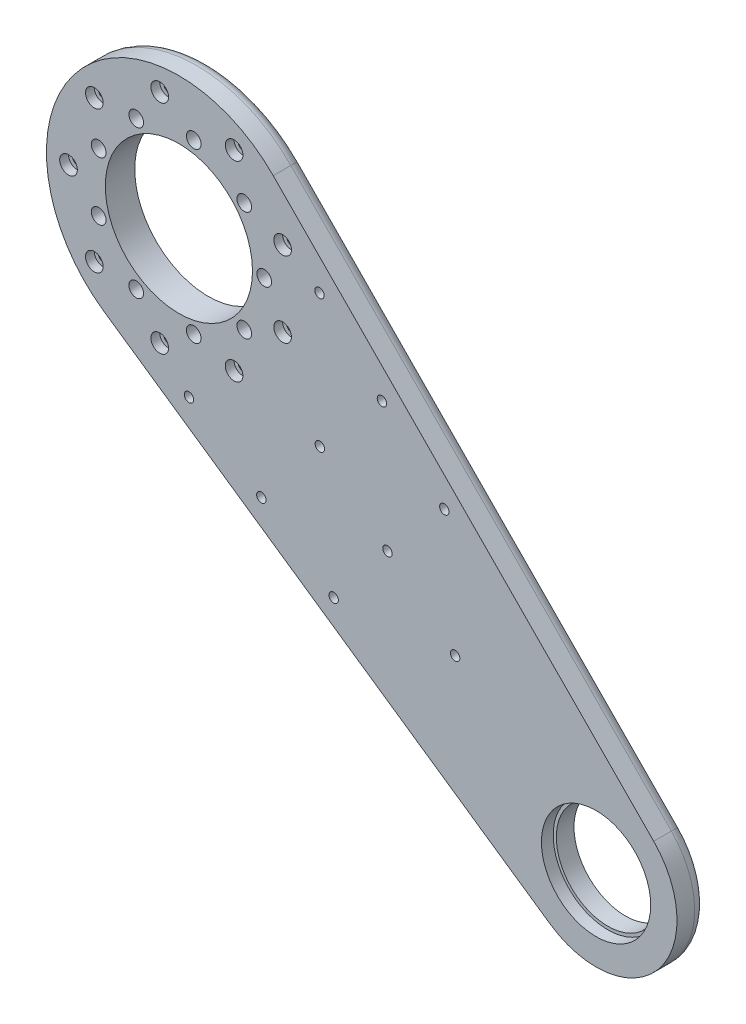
SolidWorks part; units mm, degrees
ref_plane "Front Plane" through (0, 0, 0) normal (0, 0, 1) x (1, 0, 0)
ref_plane "Top Plane" through (0, 0, 0) normal (0, 1, 0) x (1, 0, 0)
ref_plane "Right Plane" through (0, 0, 0) normal (1, 0, 0) x (0, 0, -1)
sketch "Sketch1" plane through (0, 0, 0) normal (0, 0, 1) x (1, 0, 0)
  line L0 (141.7182, -118.9157) -> (13.1607, -272.1246) construction
  line L1 (26.7138, 26.3177) -> (155.9656, -104.8796) construction
  line L2 (-25.5349, -37.0536) -> (126.1136, -141.5596)
  line L3 (32.0566, 31.5812) -> (161.3084, -99.6161)
  line L4 (-21.2791, -30.878) -> (130.3694, -135.384) construction
  line L5 (0, 0) -> (141.7182, -118.9157) construction
  arc A0 (32.0566, 31.5812) -> (-25.5349, -37.0536) centre (0, 0) ccw
  arc A1 (126.1136, -141.5596) -> (161.3084, -99.6161) centre (141.7182, -118.9157) ccw
  circle A5 centre (0, 0) radius 25 construction
  circle A6 centre (0, 0) radius 37.5 construction
  circle A7 centre (141.7182, -118.9157) radius 17.5
  circle A8 centre (70.8591, -59.4579) radius 1.6
  circle A9 centre (93.8404, -78.7415) radius 1.6
  circle A10 centre (47.8778, -40.1742) radius 1.6
  circle A11 centre (141.7182, -118.9157) radius 20 construction
  circle A12 centre (47.768, 4.9466) radius 1.6
  circle A14 centre (3.4233, -47.9013) radius 1.6
  circle A16 centre (68.9739, -16.2739) radius 1.6
  circle A17 centre (90.1797, -37.4944) radius 1.6
  circle A18 centre (28.0039, -65.1001) radius 1.6
  circle A19 centre (52.5844, -82.2989) radius 1.6
  circle A20 centre (116.8218, -98.0251) radius 1.6 construction
  point P16 (141.7182, -118.9157)
extrude "Boss-Extrude1" add sketch "Sketch1" along normal blind 10
sketch "Sketch2" plane through (0, 0, 10) normal (0, 0, 1) x (1, 0, 0)
  line L0 (0, 0) -> (141.7182, 0) construction
  circle A0 centre (0, 0) radius 25
  circle A2 centre (29, 0) radius 2.5
  circle A3 centre (-37.5, 0) radius 1.6
  circle A4 centre (0, 0) radius 37.5 construction
  circle A5 centre (-28.7267, 24.1045) radius 1.6
  circle A6 centre (-6.5118, 36.9303) radius 1.6
  circle A7 centre (18.75, 32.476) radius 1.6
  circle A8 centre (35.2385, 12.8258) radius 1.6
  circle A9 centre (35.2385, -12.8258) radius 1.6
  circle A10 centre (18.75, -32.476) radius 1.6
  circle A11 centre (-6.5118, -36.9303) radius 1.6
  circle A12 centre (-28.7267, -24.1045) radius 1.6
  circle A13 centre (22.2153, -18.6408) radius 2.5
  circle A14 centre (5.0358, -28.5594) radius 2.5
  circle A15 centre (-14.5, -25.1147) radius 2.5
  circle A16 centre (-27.2511, -9.9186) radius 2.5
  circle A17 centre (-27.2511, 9.9186) radius 2.5
  circle A18 centre (-14.5, 25.1147) radius 2.5
  circle A19 centre (5.0358, 28.5594) radius 2.5
  circle A20 centre (22.2153, 18.6408) radius 2.5
  point P30 (0, 0)
  point P46 (0, 0)
extrude "Cut-Extrude1" cut sketch "Sketch2" against normal through all
sketch "Sketch3" plane through (0, 0, 10) normal (0, 0, 1) x (1, 0, 0)
  circle A0 centre (141.7182, -118.9157) radius 18.5625
extrude "Cut-Extrude2" cut sketch "Sketch3" against normal blind 4
sketch "Sketch4" plane through (0, 0, 10) normal (0, 0, 1) x (1, 0, 0)
  circle A0 centre (-28.7267, 24.1045) radius 3
  circle A1 centre (-6.5118, 36.9303) radius 3
  circle A2 centre (18.75, 32.476) radius 3
  circle A3 centre (35.2385, 12.8258) radius 3
  circle A4 centre (35.2385, -12.8258) radius 3
  circle A5 centre (18.75, -32.476) radius 3
  circle A6 centre (-6.5118, -36.9303) radius 3
  circle A7 centre (-28.7267, -24.1045) radius 3
  circle A8 centre (-37.5, 0) radius 3
  dimension "D1" = 6
  dimension "D2" = 6
  dimension "D3" = 6
  dimension "D4" = 6
  dimension "D5" = 6
  dimension "D6" = 6
  dimension "D7" = 6
  dimension "D8" = 6
  dimension "D9" = 6
extrude "Cut-Extrude3" cut sketch "Sketch4" against normal blind 3
fillet "Fillet1" radius 4 4 edges at (162.7844, -136.5924, 0) (50.2894, -89.3066, 0) (-34.472, 28.9254, 0) (96.6825, -34.0174, 0)
equation "\"thighLength\"=185"
equation "\"legLength\"=200"
equation "\"m3Thru\"=3.2"
equation "\"m4Thru\"=4.3"
equation "\"D3@Sketch2\"=\"m3Thru\""
equation "\"shoulder5mm\"=5.1"
equation "\"6706out\"=37.125"
equation "\"D1@Sketch3\"=\"6706out\""
equation "\"6706in\"=30"
equation "\"6904out\"=30.125"
equation "\"6904in\"=17"
